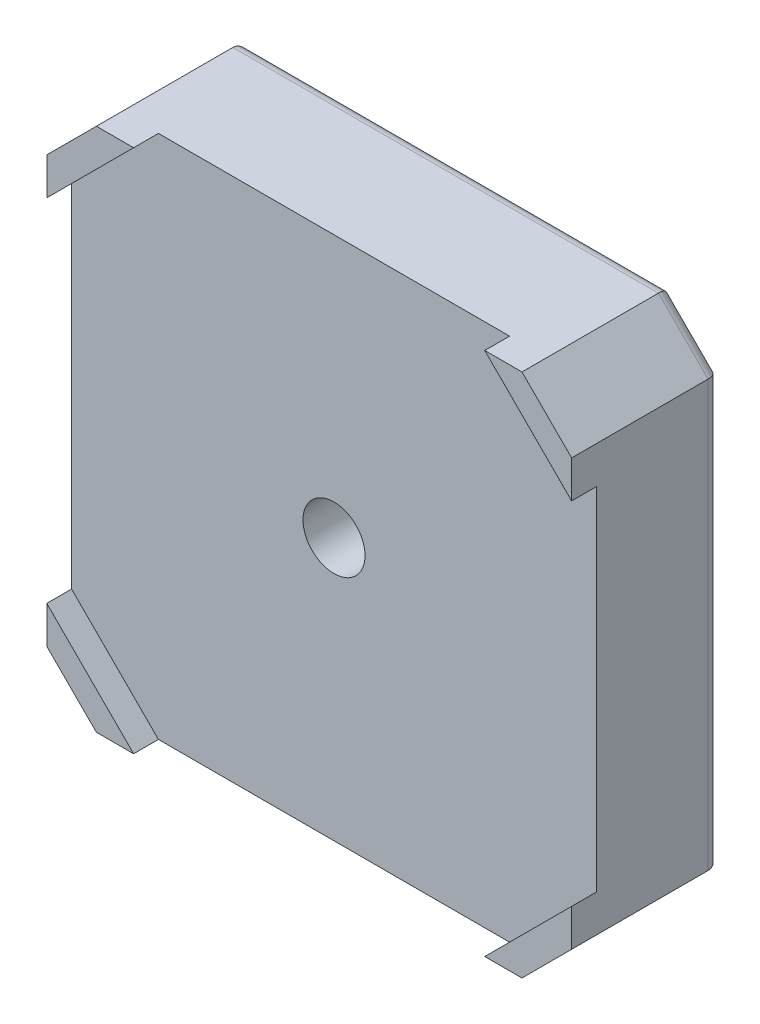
SolidWorks part; units mm, degrees
ref_plane "Front Plane" through (0, 0, 0) normal (0, 0, 1) x (1, 0, 0)
ref_plane "Top Plane" through (0, 0, 0) normal (0, 1, 0) x (1, 0, 0)
ref_plane "Right Plane" through (0, 0, 0) normal (1, 0, 0) x (0, 0, -1)
sketch "Sketch1" plane through (0, 0, 0) normal (0, 0, 1) x (1, 0, 0)
  line L0 (-21.15, 17.15) -> (-17.15, 21.15)
  line L1 (-17.15, 21.15) -> (17.15, 21.15)
  line L2 (-21.15, 17.15) -> (-21.15, -17.15)
  line L3 (-17.15, -21.15) -> (17.15, -21.15)
  line L4 (21.15, 17.15) -> (21.15, -17.15)
  line L5 (-21.15, 21.15) -> (21.15, -21.15) construction
  line L6 (-21.15, -21.15) -> (21.15, 21.15) construction
  line L7 (17.15, 21.15) -> (21.15, 17.15)
  line L8 (17.15, -21.15) -> (21.15, -17.15)
  line L9 (-21.15, -17.15) -> (-17.15, -21.15)
  point P0 (0, 0)
  dimension "D1" = 42.3
  dimension "D2" = 42.3
extrude "Boss-Extrude2" add sketch "Sketch1" along normal blind 12
sketch "Sketch2" plane through (0, 0, 12) normal (0, 0, 1) x (1, 0, 0)
  line L0 (-14.15, 21.15) -> (-21.15, 14.15)
  line L1 (-14.15, 21.15) -> (14.15, 21.15)
  line L2 (-21.15, 14.15) -> (-21.15, -14.15)
  line L3 (-14.15, -21.15) -> (14.15, -21.15)
  line L4 (21.15, 14.15) -> (21.15, -14.15)
  line L5 (-21.15, 21.15) -> (21.15, -21.15) construction
  line L6 (-21.15, -21.15) -> (21.15, 21.15) construction
  line L7 (14.15, 21.15) -> (21.15, 14.15)
  line L8 (14.15, -21.15) -> (21.15, -14.15)
  line L9 (-21.15, -14.15) -> (-14.15, -21.15)
  point P0 (0, 0)
  dimension "D1" = 42.3
  dimension "D2" = 42.3
  dimension "D3" = 42.3
extrude "Cut-Extrude1" cut sketch "Sketch2" against normal blind 2
sketch "Sketch3" plane through (0, 0, 0) normal (0, 0, -1) x (-1, 0, 0)
  circle A0 centre (0, 0) radius 11
  dimension "D1" = 22
extrude "Boss-Extrude3" add sketch "Sketch3" along normal blind 2
sketch "Sketch4" plane through (0, 0, -2) normal (0, 0, -1) x (-1, 0, 0)
  circle A0 centre (0, 0) radius 5.5
  dimension "D1" = 11
extrude "Cut-Extrude2" cut sketch "Sketch4" against normal blind 7
sketch "Sketch5" plane through (0, 0, 5) normal (0, 0, -1) x (-1, 0, 0)
  circle A0 centre (0, 0) radius 2.5
  dimension "D1" = 5
extrude "Cut-Extrude3" cut sketch "Sketch5" against normal through all
fillet "Fillet1" radius 1 8 edges at (-19.15, 19.15, 0) (-21.15, 0, 0) (-19.15, -19.15, 0) (0, -21.15, 0) (19.15, -19.15, 0) (21.15, 0, 0) (19.15, 19.15, 0) (0, 21.15, 0)
fillet "Fillet2" radius 0.5 3 edges at (-5.5, 0, 5) (-5.5, 0, -2) (-11, 0, -2)
sketch "Sketch6" plane through (0, 0, 0) normal (0, 0, -1) x (-1, 0, 0)
  line L1 (-15.5, 15.5) -> (15.5, 15.5) construction
  line L2 (-15.5, 15.5) -> (-15.5, -15.5) construction
  line L3 (-15.5, -15.5) -> (15.5, -15.5) construction
  line L4 (15.5, 15.5) -> (15.5, -15.5) construction
  line L5 (-15.5, 15.5) -> (15.5, -15.5) construction
  line L6 (-15.5, -15.5) -> (15.5, 15.5) construction
  circle A0 centre (-15.5, 15.5) radius 1.5
  circle A1 centre (15.5, 15.5) radius 1.5
  circle A2 centre (15.5, -15.5) radius 1.5
  circle A3 centre (-15.5, -15.5) radius 1.5
  point P0 (0, 0)
  dimension "D1" = 3
  dimension "D2" = 31
extrude "Cut-Extrude4" cut sketch "Sketch6" against normal blind 3
fillet "Fillet3" radius 0.5 4 edges at (14, -15.5, 0) (-17, -15.5, 0) (-17, 15.5, 0) (14, 15.5, 0)
